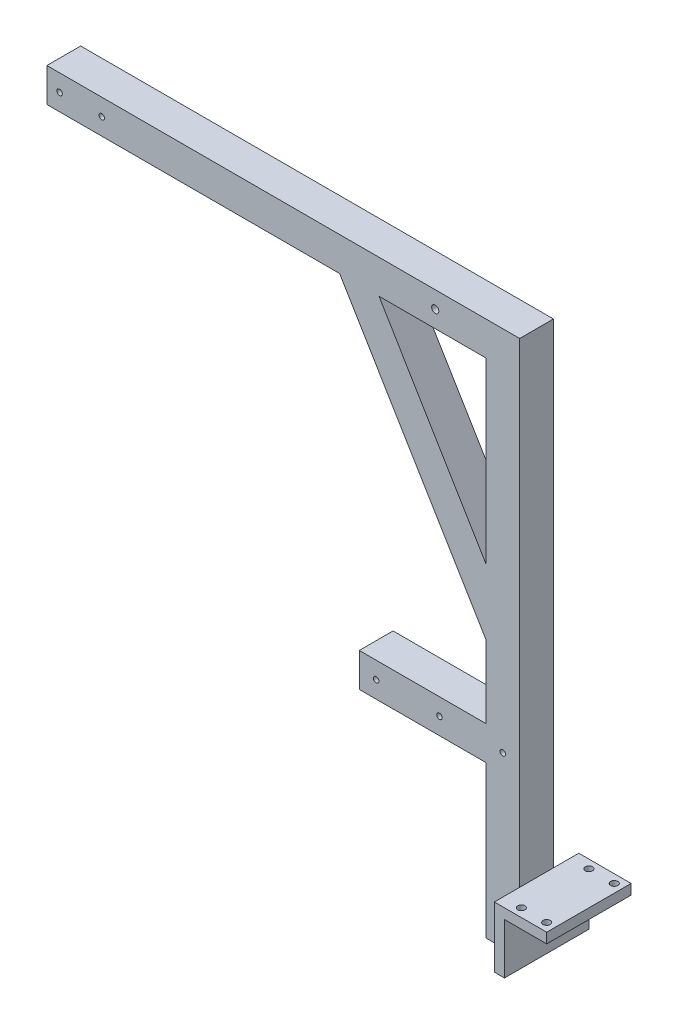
SolidWorks part; units mm, degrees
ref_plane "前视基准面" through (0, 0, 0) normal (0, 0, 1) x (1, 0, 0)
ref_plane "上视基准面" through (0, 0, 0) normal (0, 1, 0) x (1, 0, 0)
ref_plane "右视基准面" through (0, 0, 0) normal (1, 0, 0) x (0, 0, -1)
sketch "草图1" plane through (0, 0, 0) normal (0, 0, 1) x (1, 0, 0)
  line L0 (560, 72) -> (560, 595)
  line L1 (520, 0) -> (520, 180)
  line L2 (520, 0) -> (572, 0)
  line L3 (572, 60) -> (622, 60)
  line L4 (622, 60) -> (622, 72)
  line L5 (572, 0) -> (572, 60)
  line L6 (560, 72) -> (622, 72)
  line L7 (0, 635) -> (560, 635)
  line L8 (0, 595) -> (346.6762, 595)
  line L9 (560, 635) -> (560, 595)
  line L10 (0, 635) -> (0, 595)
  line L11 (520, 220) -> (370, 220)
  line L12 (520, 180) -> (370, 180)
  line L13 (370, 180) -> (370, 220)
  line L14 (346.6762, 595) -> (520, 306.127)
  line L15 (393.3238, 595) -> (520, 383.873)
  line L16 (393.3238, 595) -> (520, 595)
  line L17 (520, 383.873) -> (520, 595)
  line L18 (520, 306.127) -> (520, 220)
extrude "凸台-拉伸1" add sketch "草图1" along normal blind 100
sketch "草图2" plane through (0, 635, 0) normal (0, 1, 0) x (1, 0, 0)
  line L0 (0, -30) -> (560, -30)
  line L1 (0, -70) -> (560, -70)
  line L2 (0, -70) -> (0, -30)
  line L3 (560, -100) -> (560, -70)
  line L4 (622, -100) -> (622, 0)
  line L5 (560, 0) -> (622, 0)
  line L6 (622, -100) -> (560, -100)
  line L7 (560, -30) -> (560, 0)
  circle A0 centre (582, -10) radius 4.25
  circle A1 centre (612, -10) radius 4.25
  circle A2 centre (612, -90) radius 4.25
  circle A3 centre (582, -90) radius 4.25
extrude "切除-拉伸1" cut sketch "草图2" against normal through all flip side to cut
sketch "草图4" plane through (0, 0, 70) normal (0, 0, 1) x (1, 0, 0)
  circle A0 centre (390, 200) radius 3.25
  circle A1 centre (465, 200) radius 3.25
  circle A2 centre (540, 200) radius 3.25
  circle A3 centre (460, 615) radius 4.25
  circle A4 centre (15, 615) radius 3.25
  circle A5 centre (65, 615) radius 3.25
extrude "切除-拉伸2" cut sketch "草图4" against normal blind 100
